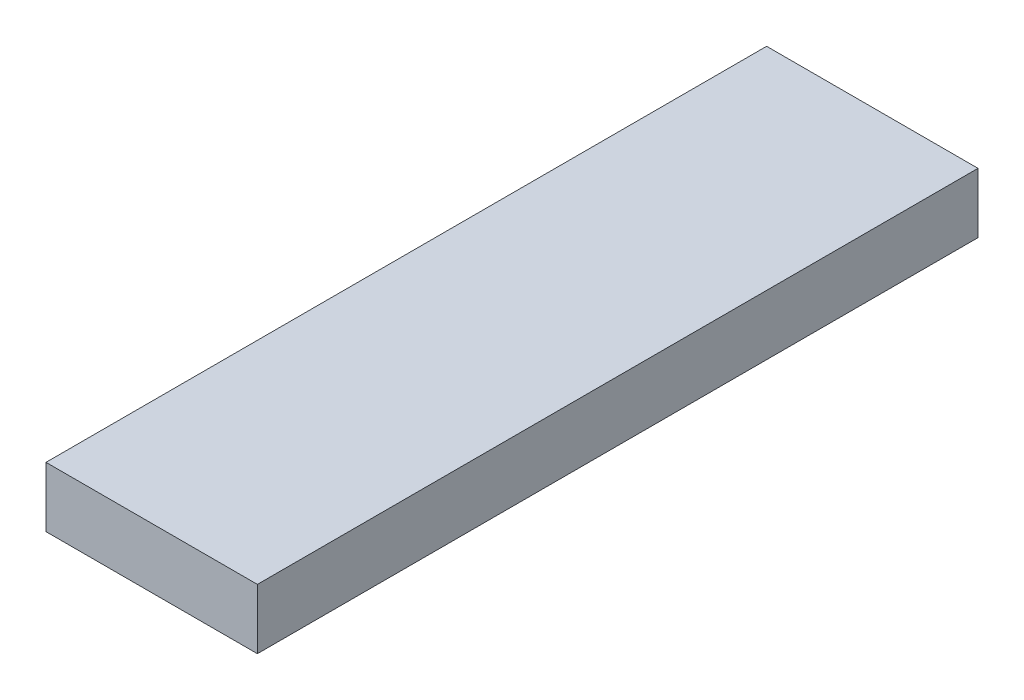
SolidWorks part; units mm, degrees
ref_plane "前视基准面" through (0, 0, 0) normal (0, 0, 1) x (1, 0, 0)
ref_plane "上视基准面" through (0, 0, 0) normal (0, 1, 0) x (1, 0, 0)
ref_plane "右视基准面" through (0, 0, 0) normal (1, 0, 0) x (0, 0, -1)
sketch "草图1" plane through (0, 0, 0) normal (0, 1, 0) x (1, 0, 0)
  line L1 (0, 0) -> (44, 0)
  line L2 (0, 0) -> (0, 150)
  line L3 (0, 150) -> (44, 150)
  line L4 (44, 0) -> (44, 150)
  dimension "D1" = 44
  dimension "D2" = 150
extrude "凸台-拉伸1" add sketch "草图1" along normal blind 12.5
